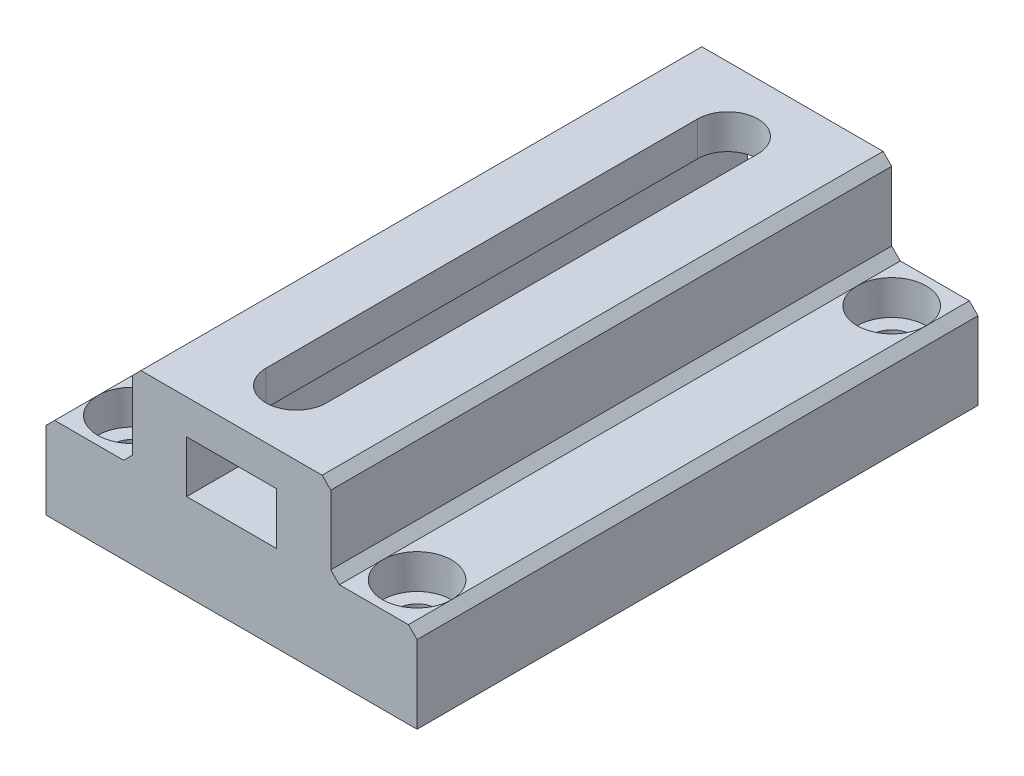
SolidWorks part; units mm, degrees
ref_plane "Front Plane" through (0, 0, 0) normal (0, 0, 1) x (1, 0, 0)
ref_plane "Top Plane" through (0, 0, 0) normal (0, 1, 0) x (1, 0, 0)
ref_plane "Right Plane" through (0, 0, 0) normal (1, 0, 0) x (0, 0, -1)
sketch "Sketch1" plane through (0, 0, 0) normal (0, 1, 0) x (1, 0, 0)
  line L1 (-21.5, 32.5) -> (21.5, 32.5)
  line L2 (-21.5, 32.5) -> (-21.5, -32.5)
  line L3 (-21.5, -32.5) -> (21.5, -32.5)
  line L4 (21.5, 32.5) -> (21.5, -32.5)
  line L5 (-21.5, 32.5) -> (21.5, -32.5) construction
  line L6 (-21.5, -32.5) -> (21.5, 32.5) construction
  point P0 (0, 0)
  dimension "D1" = 43
  dimension "D2" = 65
extrude "Boss-Extrude1" add sketch "Sketch1" along normal blind 20
sketch "Sketch2" plane through (0, 0, 32.5) normal (0, 0, 1) x (1, 0, 0)
  line L0 (-21.5, 0) -> (21.5, 0) construction
  line L1 (-21.5, 20) -> (-11.5, 20)
  line L2 (-21.5, 20) -> (-21.5, 10)
  line L3 (-21.5, 10) -> (-11.5, 10)
  line L4 (-11.5, 20) -> (-11.5, 10)
  dimension "D1" = 10
  dimension "D2" = 10
extrude "Cut-Extrude1" cut sketch "Sketch2" against normal through all
mirror "Mirror1" about plane through (0, 0, 0) normal (1, 0, 0) of "Cut-Extrude1"
sketch "Sketch3" plane through (0, 0, 32.5) normal (0, 0, 1) x (1, 0, 0)
  line L0 (55, 0) -> (-55, 0) construction
  line L1 (-5.2, 0) -> (5.2, 0)
  line L2 (-5.2, 0) -> (-5.2, 16)
  line L3 (-5.2, 16) -> (5.2, 16)
  line L5 (0, -55) -> (0, 55) construction
  line L6 (0, 7.9112) -> (0, -2.6957) construction
  line L7 (5.2, 0) -> (5.2, 16)
  dimension "D1" = 10.4
  dimension "D2" = 5.2
  dimension "D3" = 16
extrude "Cut-Extrude2" cut sketch "Sketch3" against normal through all
sketch "Sketch5" plane through (0, 20, 0) normal (0, 1, 0) x (1, 0, 0)
  line L0 (0, -25) -> (0, 25) construction
  line L1 (0, -55) -> (0, 55) construction
  line L2 (-3.5, -25) -> (-3.5, 25)
  line L3 (3.5, -25) -> (3.5, 25)
  line L4 (-55, 0) -> (55, 0) construction
  arc A0 (-3.5, -25) -> (3.5, -25) centre (0, -25) ccw
  arc A1 (3.5, 25) -> (-3.5, 25) centre (0, 25) ccw
  point P5 (0, 0)
  dimension "D3" = 3.5
  dimension "D1" = 50
  dimension "D2" = 25
extrude "Cut-Extrude4" cut sketch "Sketch5" against normal through all
hole_wizard "CBORE for M4 SHCS1" positions "Sketch6" profile "Sketch7" counterbore size "M4" standard "ANSI Metric"
sketch "Sketch6" plane through (0, 10, 0) normal (0, 1, 0) x (1, 0, 0)
  line L0 (21.5, -32.5) -> (11.5, -32.5) construction
  line L1 (0, -55) -> (0, 55) construction
  point P0 (16.5, -27.5)
  dimension "D1" = 5
  dimension "D2" = 16.5
sketch "Sketch7" plane through (16.5, 10, 27.5) normal (1, 0, 0) x (0, 0, 1)
  line L0 (0, 0) -> (0, 10)
  line L1 (0, 10) -> (2.25, 10)
  line L3 (2.25, 10) -> (2.25, 4)
  line L4 (2.25, 4) -> (4, 4)
  line L5 (4, 4) -> (4, 0)
  line L7 (4, 0) -> (0, 0)
  line L11 (0, -6.35) -> (0, 107.95) construction
  dimension "Thru Hole Dia." = 4.5
  dimension "Thru Hole Depth" = 10
  dimension "C'Bore Dia." = 8
  dimension "C'Bore Depth" = 4
pattern_linear "LPattern1" count 2 spacing 55 along (0, 0, -1) count 2 spacing 33 along (-1, 0, 0) of "CBORE for M4 SHCS1"
chamfer "Chamfer3" distance 1 angle 45 6 edges at (-21.5, 10, 0) (-11.5, 10, 0) (-11.5, 20, 0) (11.5, 20, 0) (11.5, 10, 0) (21.5, 10, 0)
sketch "Sketch8" plane through (0, 0, 32.5) normal (0, 0, 1) x (1, 0, 0)
  line L0 (55, 0) -> (-55, 0) construction
  line L1 (-5.2061, 0) -> (5.2, 0)
  line L2 (-5.2061, 0) -> (-5.2061, 10)
  line L3 (-5.2061, 10) -> (5.2, 10)
  line L4 (5.2, 0) -> (5.2, 10)
  line L5 (5.2, 0) -> (5.2, 16) construction
  dimension "D1" = 10
extrude "Boss-Extrude2" add sketch "Sketch8" against normal through all
